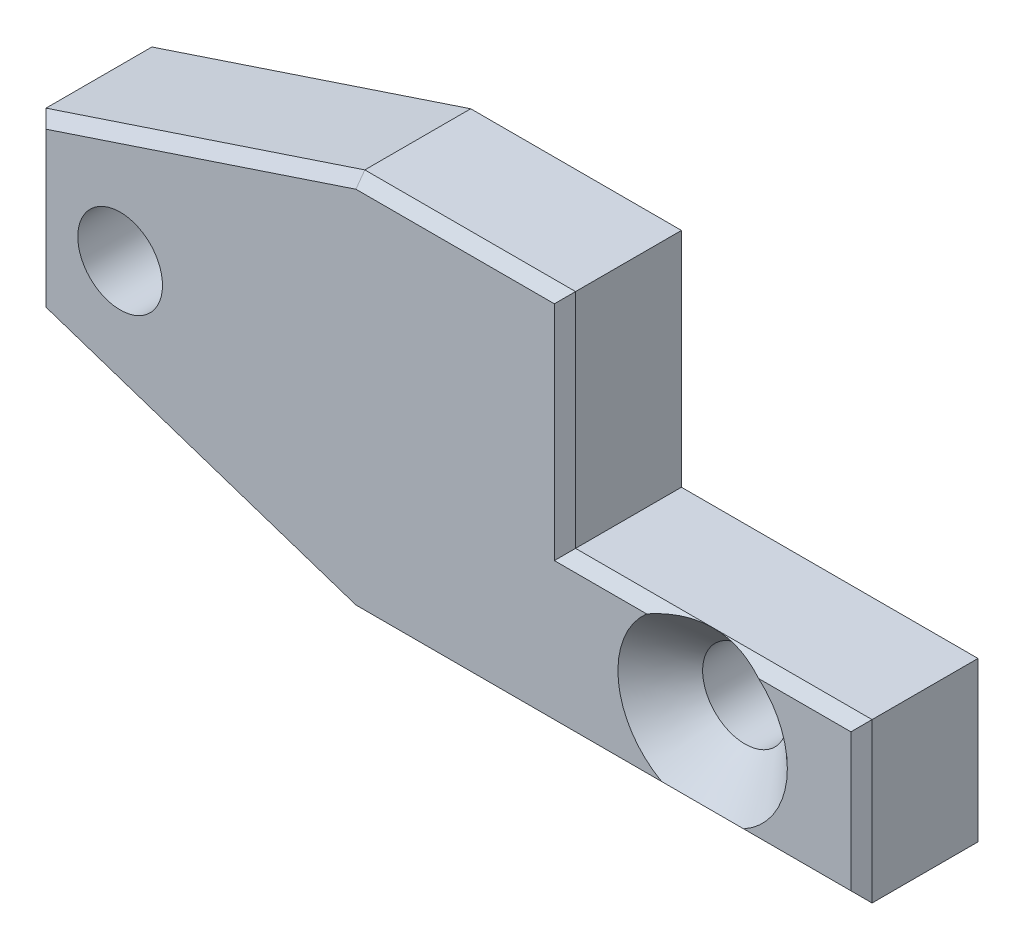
SolidWorks part; units mm, degrees
ref_plane "Plan1" through (0, 0, 0) normal (0, 0, 1) x (1, 0, 0)
ref_plane "Plan2" through (0, 0, 0) normal (0, 1, 0) x (1, 0, 0)
ref_plane "Plan3" through (0, 0, 0) normal (1, 0, 0) x (0, 0, -1)
sketch "Esquisse1" plane through (0, 0, 0) normal (0, 0, 1) x (1, 0, 0)
  line L0 (0, 10.5) -> (0, 0)
  line L1 (0, 0) -> (14, 0)
  line L2 (14, 0) -> (14, -7.5)
  line L3 (0, 10.5) -> (-9.9488, 10.5)
  line L4 (-9.9488, 10.5) -> (-25, 5.5)
  line L5 (-25, 5.5) -> (-25, -2.5)
  line L6 (-25, -2.5) -> (-9.9488, -7.5)
  line L7 (-9.9488, -7.5) -> (14, -7.5)
  dimension "D1" = 10.5
  dimension "D2" = 14
  dimension "D3" = 7.5
  dimension "D4" = 5
  dimension "D5" = 25
  dimension "D6" = 5
extrude "Base-Extrusion" add sketch "Esquisse1" along normal blind 6
chamfer "Chanfrein3" distance 0.5 angle 45
sketch "Esquisse2" plane through (0, 0, 6) normal (0, 0, 1) x (1, 0, 0)
  line L0 (-21, 12) -> (-21, -6) construction
  line L1 (-28, 1.5) -> (-15, 1.5) construction
  line L2 (0, 10.5) -> (0, 0) construction
  circle A0 centre (-21, 1.5) radius 2
  dimension "D3" = 4
  dimension "D2" = 21
extrude "Enlèv. mat.-Extru.1" cut sketch "Esquisse2" against normal blind 6
sketch "Esquisse3" plane through (0, 0, 6) normal (0, 0, 1) x (1, 0, 0)
  line L0 (6.5, 1.5) -> (6.5, -11.3631) construction
  line L1 (3, -3.5) -> (15, -3.5) construction
  line L2 (-9.9488, -7.5) -> (14, -7.5) construction
  line L3 (14, 0) -> (14, -7.5) construction
  circle A0 centre (6.5, -3.5) radius 2
  dimension "D3" = 4
  dimension "D1" = 4
  dimension "D2" = 7.5
extrude "Enlèv. mat.-Extru.2" cut sketch "Esquisse3" against normal blind 6
chamfer "Chanfrein1" distance 2 angle 45
